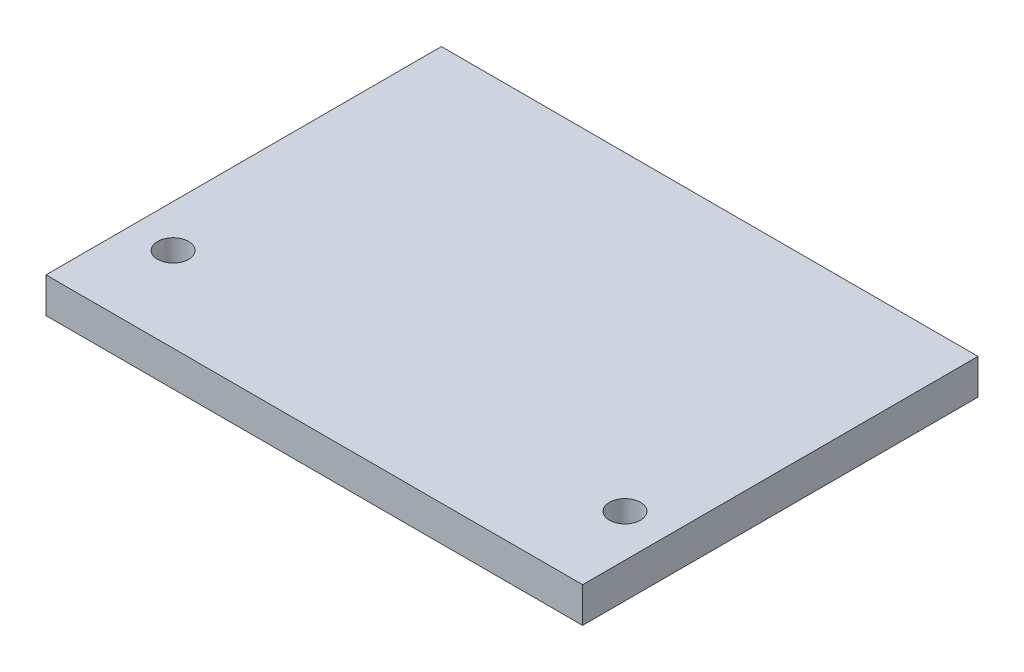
SolidWorks part; units mm, degrees
ref_plane "Plan de face" through (0, 0, 0) normal (0, 0, 1) x (1, 0, 0)
ref_plane "Plan de dessus" through (0, 0, 0) normal (0, 1, 0) x (1, 0, 0)
ref_plane "Plan de droite" through (0, 0, 0) normal (1, 0, 0) x (0, 0, -1)
sketch "Esquisse1" plane through (0, 0, 0) normal (0, 1, 0) x (1, 0, 0)
  line L0 (19, 0) -> (19, 28) construction
  line L1 (0, 0) -> (38, 0)
  line L2 (0, 0) -> (0, 28)
  line L3 (0, 28) -> (38, 28)
  line L4 (38, 0) -> (38, 28)
  circle A0 centre (35, 6) radius 1.1
  circle A1 centre (3, 6) radius 1.1
  dimension "D3" = 3
  dimension "D4" = 6
  dimension "D1" = 38
  dimension "D2" = 28
extrude "Extrusion1" add sketch "Esquisse1" along normal blind 2.5
